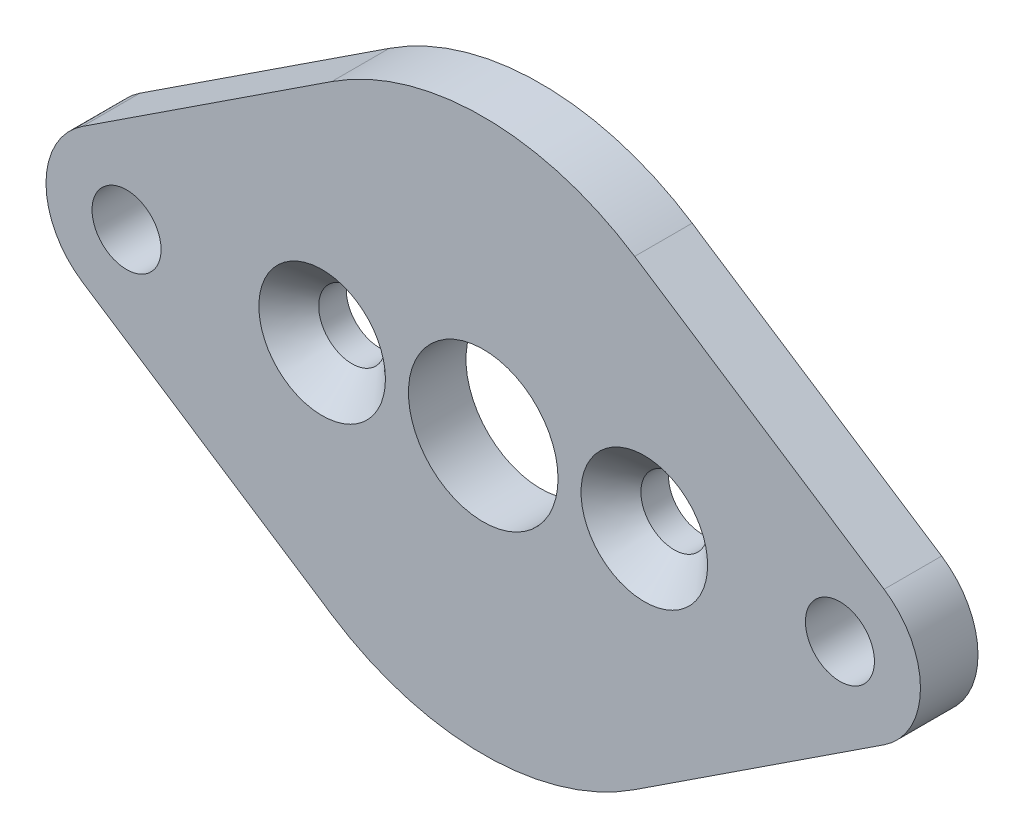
SolidWorks part; units mm, degrees
ref_plane "Plan de face" through (0, 0, 0) normal (0, 0, 1) x (1, 0, 0)
ref_plane "Plan de dessus" through (0, 0, 0) normal (0, 1, 0) x (1, 0, 0)
ref_plane "Plan de droite" through (0, 0, 0) normal (1, 0, 0) x (0, 0, -1)
sketch "Esquisse1" plane through (0, 0, 0) normal (0, 0, 1) x (1, 0, 0)
  line L0 (-21.7712, 0) -> (21.7811, 0) construction
  line L1 (0, 18.0174) -> (0, -16.6631) construction
  line L2 (-15.5, 12.196) -> (-15.5, 0) construction
  line L3 (15.5, 0) -> (15.5, 12.196) construction
  line L6 (-17.4194, 2.9268) -> (-6.5806, 10.0347)
  line L7 (17.4194, -2.9268) -> (6.5806, -10.0347)
  line L9 (-17.4194, -2.9268) -> (-6.5806, -10.0347)
  line L10 (6.5806, 10.0347) -> (17.4194, 2.9268)
  arc A0 (-17.4194, 2.9268) -> (-17.4194, -2.9268) centre (-15.5, 0) ccw
  circle A1 centre (-15.5, 0) radius 1.5
  circle A2 centre (0, 0) radius 3.25
  arc A4 (17.4194, -2.9268) -> (17.4194, 2.9268) centre (15.5, 0) ccw
  circle A5 centre (15.5, 0) radius 1.5
  arc A6 (6.5806, 10.0347) -> (-6.5806, 10.0347) centre (0, 0) ccw
  arc A7 (-6.5806, -10.0347) -> (6.5806, -10.0347) centre (0, 0) ccw
  dimension "D3" = 3
  dimension "D5" = 2
  dimension "D6" = 12
  dimension "D1" = 6.5
  dimension "D2" = 31
extrude "Base losange" add sketch "Esquisse1" along normal blind 2.5
hole_wizard "Fraisures pour vis M2.5" positions "Esquisse3" profile "Esquisse2" countersink size "M2.5" standard "ISO"
sketch "Esquisse3" plane through (0, 0, 2.5) normal (0, 0, 1) x (1, 0, 0)
  line L0 (-15.5, 0) -> (15.5, 0) construction
  line L1 (0, 0) -> (0, 8.7125) construction
  point P16 (-7, 0)
  point P18 (7, 0)
  dimension "D1" = 14
sketch "Esquisse2" plane through (-7, 0, 2.5) normal (1, 0, 0) x (0, -1, 0)
  line L0 (0, 0) -> (0, 2.5)
  line L1 (0, 2.5) -> (1.45, 2.5)
  line L2 (1.45, 2.5) -> (1.45, 1.3)
  line L3 (1.45, 1.3) -> (2.75, 0)
  line L5 (2.75, 0) -> (0, 0)
  line L6 (-1.45, 1.3) -> (-2.75, 0) construction
  line L11 (0, -6.35) -> (0, 107.95) construction
  dimension "Diamètre du perçage jusqu'au prochain" = 2.9
  dimension "Profondeur du perçage jusqu'au prochain" = 2.5
  dimension "Diamètre du fraisage entrant" = 5.5
  dimension "Angle du fraisage entrant" = 90
